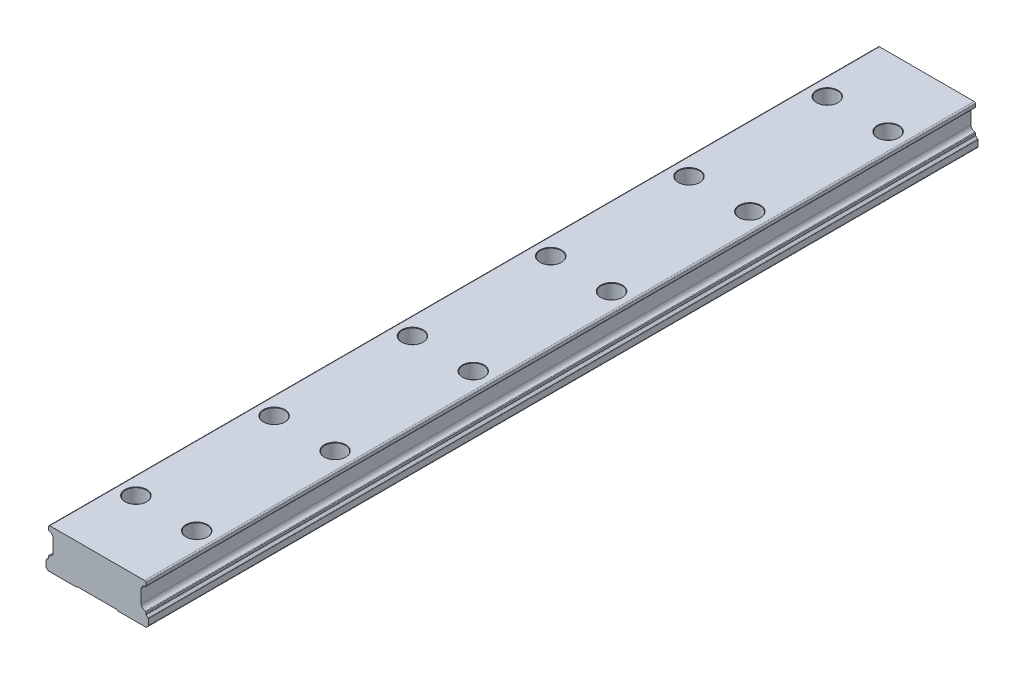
SolidWorks part; units mm, degrees
ref_plane "基準面1" through (0, 0, 0) normal (0, 0, 1) x (1, 0, 0)
ref_plane "基準面2" through (0, 0, 0) normal (0, 1, 0) x (1, 0, 0)
ref_plane "基準面3" through (0, 0, 0) normal (1, 0, 0) x (0, 0, -1)
sketch "草圖11" plane through (0, 0, 0) normal (0, 0, 1) x (1, 0, 0)
  line L0 (0, 0) -> (0, 16.4047) construction
  line L1 (-17.5, 11.05) -> (-17.5, 6.55) construction
  circle A0 centre (-17.5, 11.05) radius 1.5875
  circle A1 centre (-17.5, 6.55) radius 1.5875
  circle A2 centre (17.5, 6.55) radius 1.5875
  circle A3 centre (17.5, 11.05) radius 1.5875
  dimension "D1" = 6.55
  dimension "D2" = 4.5
  dimension "D3" = 3.175
  dimension "D4" = 35
sketch "草圖1" plane through (0, 0, 0) normal (0, 0, 1) x (1, 0, 0)
  line L0 (-9.0449, 8.8) -> (10.9551, 8.8) construction
  line L1 (-17.75, 0) -> (-7.5, 0)
  line L2 (-18.5, 0.9571) -> (-18.5, 3.0782)
  line L3 (-17.1, 14.4) -> (17.1, 14.4)
  line L4 (18.5, 0.9571) -> (18.5, 3.0782)
  line L5 (0, 0) -> (0, 20) construction
  line L6 (-15.9109, 11.2398) -> (-15.9109, 6.3602)
  line L7 (15.9109, 6.3602) -> (15.9109, 11.2398)
  line L9 (17.6, 4.7041) -> (17.6, 4.0666)
  line L10 (-17.6893, 3.8751) -> (-18.4107, 3.2697)
  line L11 (-17.6, 12.8959) -> (-17.6, 13.9)
  line L12 (17.6, 12.8959) -> (17.6, 13.9)
  line L13 (17.6893, 3.8751) -> (18.4107, 3.2697)
  line L14 (-17.6, 4.7041) -> (-17.6, 4.0666)
  line L18 (-18.3536, 0.6036) -> (-17.75, 0)
  line L19 (18.3536, 0.6036) -> (17.75, 0)
  line L23 (17.5442, 11.0058) -> (17.5, 11.05) construction
  line L24 (-7.5, 0) -> (-7.2, 0.3)
  line L25 (-7.2, 0.3) -> (7.2, 0.3)
  line L28 (7.5, 0) -> (7.2, 0.3)
  line L30 (7.5, 0) -> (17.75, 0)
  arc A0 (-15.9109, 11.2398) -> (-17.3756, 12.6472) centre (-17.5442, 11.0058) ccw
  arc A1 (-17.3756, 4.9528) -> (-15.9109, 6.3602) centre (-17.5442, 6.5942) ccw
  arc A2 (17.3756, 4.9528) -> (15.9109, 6.3602) centre (17.5442, 6.5942) cw
  arc A3 (15.9109, 11.2398) -> (17.3756, 12.6472) centre (17.5442, 11.0058) cw
  arc A4 (-17.3756, 4.9528) -> (-17.6, 4.7041) centre (-17.35, 4.7041) ccw
  arc A5 (-17.3756, 12.6472) -> (-17.6, 12.8959) centre (-17.35, 12.8959) cw
  arc A9 (17.6, 4.7041) -> (17.3756, 4.9528) centre (17.35, 4.7041) ccw
  arc A11 (17.6, 12.8959) -> (17.3756, 12.6472) centre (17.35, 12.8959) cw
  arc A16 (-17.6893, 3.8751) -> (-17.6, 4.0666) centre (-17.85, 4.0666) ccw
  arc A17 (-18.5, 3.0782) -> (-18.4107, 3.2697) centre (-18.25, 3.0782) cw
  arc A18 (17.6893, 3.8751) -> (17.6, 4.0666) centre (17.85, 4.0666) cw
  arc A19 (18.5, 3.0782) -> (18.4107, 3.2697) centre (18.25, 3.0782) ccw
  arc A20 (-17.6, 13.9) -> (-17.1, 14.4) centre (-17.1, 13.9) cw
  arc A21 (17.6, 13.9) -> (17.1, 14.4) centre (17.1, 13.9) ccw
  circle A22 centre (17.5, 11.05) radius 1.5875 construction
  arc A23 (-18.3536, 0.6036) -> (-18.5, 0.9571) centre (-18, 0.9571) cw
  arc A24 (18.3536, 0.6036) -> (18.5, 0.9571) centre (18, 0.9571) ccw
  point P31 (-17.6, 4.9451)
  point P34 (-17.6, 12.6549)
  point P46 (17.6, 4.9451)
  point P52 (17.6, 12.6549)
  point P67 (-17.6, 3.95)
  point P70 (-18.5, 3.1948)
  point P73 (17.6, 3.95)
  point P76 (18.5, 3.1948)
  point P89 (-17.6, 3.95)
  point P90 (-17.6, 3.95)
  point P96 (-18.5, 0.75)
  point P99 (18.5, 0.75)
  dimension "D4" = 1.65
  dimension "D6" = 35.2
  dimension "D9" = 5.6
  dimension "D11" = 35.0884
  dimension "D13" = 0.25
  dimension "D14" = 0.5
  dimension "D20" = 0.5
  dimension "D26" = 4.4116
  dimension "D28" = 0.5
  dimension "D3" = 8.8
  dimension "D10" = 130
  dimension "D12" = 4.85
  dimension "D15" = 35.2
  dimension "D16" = 45
  dimension "D17" = 0.75
  dimension "D18" = 37
  dimension "D21" = 1.0041
  dimension "D22" = 45
  dimension "D23" = 0.3
  dimension "D24" = 5.6
  dimension "D25" = 15
  dimension "D29" = 2.4448
  dimension "D30" = 0.7552
extrude "Extrude" add sketch "草圖1" along normal blind 300
sketch "草圖2" plane through (0, 0, 300) normal (0, 0, 1) x (1, 0, 0)
  line L0 (0, 0) -> (0, 15.6466) construction
  line L1 (-9.1116, 8.8) -> (10.0748, 8.8) construction
  line L2 (-17.75, 0) -> (-7.5, 0) construction
  line L3 (17.5, 6.55) -> (17.3756, 4.9528) construction
  line L4 (17.5, 6.55) -> (15.9109, 6.3602) construction
  line L5 (17.5, 6.55) -> (10.0696, -0.8804) construction
  line L6 (18.5, 0.9571) -> (18.5, 3.0782) construction
  line L7 (-17.3756, 12.6472) -> (-7.3819, 11.6204) construction
  line L8 (-17.5, 11.05) -> (-8.4279, 20.1221) construction
  line L9 (-17.5, 11.05) -> (-17.3756, 12.6472) construction
  line L10 (-17.5, 11.05) -> (-15.9109, 11.2398) construction
  line L11 (-17.5, 11.05) -> (-13.5587, 10.4961) construction
  line L12 (17.1, 14.4) -> (-17.1, 14.4) construction
  line L13 (-17.75, 0) -> (-7.5, 0) construction
  circle A0 centre (-17.5, 11.05) radius 1.5875
  circle A1 centre (-17.5, 6.55) radius 1.5875
  circle A2 centre (17.5, 6.55) radius 1.5875
  circle A3 centre (17.5, 11.05) radius 1.5875
  arc A4 (-15.9109, 11.2398) -> (-17.3756, 12.6472) centre (-17.5442, 11.0058) ccw construction
  arc A5 (-15.9109, 11.2398) -> (-17.3756, 12.6472) centre (-17.5442, 11.0058) ccw construction
  dimension "D2" = 35
  dimension "D3" = 4.5
  dimension "D4" = 3.175
  dimension "D14" = 3.35
  dimension "D15" = 6.55
  dimension "D1" = 8.8
  dimension "D5" = 45
  dimension "D6" = 38.188
  dimension "D7" = 40.545
  dimension "D8" = 185.866
  dimension "D9" = 45
  dimension "D10" = 230.866
  dimension "D11" = 40.545
  dimension "D12" = 38.188
  dimension "D13" = 8
sketch "草圖3" plane through (0, 0, 300) normal (0, 0, 1) x (1, 0, 0)
  line L1 (0, 14.55) -> (0, 5.1376) construction
  line L3 (7.7, -0.2) -> (17.9743, -0.2)
  line L6 (0, 0) -> (0, 20) construction
  line L7 (-15.9, 8.8) -> (-2.3425, 8.8) construction
  line L8 (-9.0449, 8.8) -> (10.9551, 8.8) construction
  line L11 (-18.3536, 0.6036) -> (-17.75, 0) construction
  line L15 (-7.2, 0.3) -> (-7.5, 0)
  line L16 (7.5, 0) -> (7.2, 0.3)
  line L18 (-18.5657, 0.3914) -> (-17.8743, -0.3)
  line L19 (-19.0004, 0.8261) -> (-17.9743, -0.2)
  line L20 (-17.9743, -0.2) -> (-7.7, -0.2)
  line L21 (-17.75, 0) -> (-7.5, 0) construction
  line L22 (-17.4, 14.55) -> (17.4, 14.55)
  line L23 (17.1, 14.4) -> (-17.1, 14.4) construction
  line L24 (17.8743, -0.3) -> (18.5657, 0.3914)
  line L25 (17.9743, -0.2) -> (18.5657, 0.3914)
  line L29 (7.2, 0.3) -> (-7.2, 0.3)
  line L31 (-7.2, 0.3) -> (-7.7, -0.2)
  line L33 (7.7, -0.2) -> (7.2, 0.3)
  line L36 (-18.8, 3.0782) -> (-18.8, 0.9571)
  line L38 (-17.8743, -0.3) -> (-7.3757, -0.3)
  line L39 (-16.2109, 11.2174) -> (-16.2109, 6.3826)
  line L40 (18.8, 0.9571) -> (18.8, 3.0782)
  line L41 (18.6035, 3.4996) -> (17.9, 4.0899)
  line L42 (17.9, 4.0899) -> (17.9, 4.7041)
  line L43 (-16.2109, 11.2174) -> (-16.2109, 6.3826)
  line L44 (16.2109, 6.3826) -> (16.2109, 11.2174)
  line L45 (16.2109, 6.3826) -> (16.2109, 11.2174)
  line L46 (17.9, 12.8959) -> (17.9, 13.9)
  line L47 (17.1, 14.7) -> (-17.1, 14.7)
  line L48 (-17.9, 13.9) -> (-17.9, 12.8959)
  line L52 (-17.9, 4.7041) -> (-17.9, 4.0899)
  line L53 (-17.9, 4.0899) -> (-18.6035, 3.4996)
  line L54 (-18.8, 3.0782) -> (-18.8, 0.9571)
  line L55 (7.2, 0.3) -> (-7.2, 0.3)
  line L56 (-7.3757, -0.3) -> (-7.0757, 0)
  line L58 (18.8, 0.9571) -> (18.8, 3.0782)
  line L59 (18.6035, 3.4996) -> (18.0786, 3.94)
  line L60 (17.9, 4.8501) -> (17.9, 4.323)
  line L61 (-7.0757, 0) -> (7.0757, 0)
  line L64 (17.9, 12.7499) -> (17.9, 14.05)
  line L66 (-17.9, 14.05) -> (-17.9, 12.7499)
  line L70 (-17.9, 4.8501) -> (-17.9, 4.323)
  line L71 (-18.0786, 3.94) -> (-18.6035, 3.4996)
  line L77 (7.0757, 0) -> (7.3757, -0.3)
  line L79 (7.3757, -0.3) -> (17.8743, -0.3)
  arc A0 (-18.0786, 3.94) -> (-17.9, 4.323) centre (-18.4, 4.323) ccw
  arc A1 (18.0786, 3.94) -> (17.9, 4.323) centre (18.4, 4.323) cw
  arc A2 (-17.9, 14.05) -> (-17.4, 14.55) centre (-17.4, 14.05) cw
  arc A3 (17.4, 14.55) -> (17.9, 14.05) centre (17.4, 14.05) cw
  arc A4 (-16.3296, 11.3012) -> (-17.4412, 12.2516) centre (-17.5442, 11.0058) ccw
  arc A5 (-15.9109, 11.2398) -> (-17.3756, 12.6472) centre (-17.5442, 11.0058) ccw construction
  arc A6 (-17.9, 12.7499) -> (-17.4412, 12.2516) centre (-17.4, 12.7499) ccw
  arc A7 (-16.1219, 11.0038) -> (-16.3296, 11.3012) centre (-15.8437, 11.4193) cw
  arc A8 (15.9, 10.5883) -> (16.1219, 11.0038) centre (16.4, 10.5883) cw
  arc A9 (16.1219, 11.0038) -> (16.3296, 11.3012) centre (15.8437, 11.4193) ccw
  arc A10 (17.9, 12.7499) -> (17.4412, 12.2516) centre (17.4, 12.7499) cw
  arc A11 (16.3296, 11.3012) -> (17.4412, 12.2516) centre (17.5442, 11.0058) cw
  arc A12 (-16.3296, 6.2988) -> (-17.4412, 5.3484) centre (-17.5442, 6.5942) cw
  arc A13 (-17.9, 4.8501) -> (-17.4412, 5.3484) centre (-17.4, 4.8501) cw
  arc A14 (-16.3296, 6.2988) -> (-16.1219, 6.5962) centre (-15.8437, 6.1807) cw
  arc A15 (16.3296, 6.2988) -> (16.1219, 6.5962) centre (15.8437, 6.1807) ccw
  arc A16 (17.9, 4.8501) -> (17.4412, 5.3484) centre (17.4, 4.8501) ccw
  arc A17 (16.3296, 6.2988) -> (17.4412, 5.3484) centre (17.5442, 6.5942) ccw
  arc A25 (-15.9, 10.5883) -> (-16.1219, 11.0038) centre (-16.4, 10.5883) ccw
  arc A26 (-15.9, 7.0117) -> (-16.1219, 6.5962) centre (-16.4, 7.0117) cw
  arc A28 (15.9, 7.0117) -> (16.1219, 6.5962) centre (16.4, 7.0117) ccw
  arc A30 (-17.1, 14.7) -> (-17.9, 13.9) centre (-17.1, 13.9) ccw
  arc A32 (17.9, 13.9) -> (17.1, 14.7) centre (17.1, 13.9) ccw
  arc A44 (18.8, 3.0782) -> (18.6035, 3.4996) centre (18.25, 3.0782) ccw
  arc A46 (17.9, 4.7041) -> (17.4062, 5.2513) centre (17.35, 4.7041) ccw
  arc A47 (16.2109, 6.3826) -> (17.4062, 5.2513) centre (17.5442, 6.5942) ccw
  arc A52 (17.4062, 12.3487) -> (16.2109, 11.2174) centre (17.5442, 11.0058) ccw
  arc A53 (17.4062, 12.3487) -> (17.9, 12.8959) centre (17.35, 12.8959) ccw
  arc A54 (-18.8, 0.9571) -> (-18.5657, 0.3914) centre (-18, 0.9571) ccw
  arc A55 (-18.8, 0.9571) -> (-18.5657, 0.3914) centre (-18, 0.9571) ccw
  arc A56 (-17.9, 12.8959) -> (-17.4062, 12.3487) centre (-17.35, 12.8959) ccw
  arc A57 (-16.2109, 11.2174) -> (-17.4062, 12.3487) centre (-17.5442, 11.0058) ccw
  arc A59 (18.5657, 0.3914) -> (18.8, 0.9571) centre (18, 0.9571) ccw
  arc A60 (18.5657, 0.3914) -> (18.8, 0.9571) centre (18, 0.9571) ccw
  arc A62 (-17.4062, 5.2513) -> (-16.2109, 6.3826) centre (-17.5442, 6.5942) ccw
  arc A63 (-17.4062, 5.2513) -> (-17.9, 4.7041) centre (-17.35, 4.7041) ccw
  arc A65 (-18.6035, 3.4996) -> (-18.8, 3.0782) centre (-18.25, 3.0782) ccw
  arc A66 (18.8, 3.0782) -> (18.6035, 3.4996) centre (18.25, 3.0782) ccw
  arc A87 (-18.6035, 3.4996) -> (-18.8, 3.0782) centre (-18.25, 3.0782) ccw
  dimension "D4" = 0.5
  dimension "D5" = 0.5
  dimension "D6" = 2.5
  dimension "D7" = 0.5
  dimension "D8" = 0.5
  dimension "D9" = 0.5
  dimension "D11" = 0.5
  dimension "D12" = 0.5
  dimension "D13" = 1.7883
  dimension "D2" = 0.2
  dimension "D3" = 0.15
  dimension "D10" = 0
  dimension "D1" = 0.3
sketch "草圖6" [suppressed] plane through (0, 0, 100) normal (0, 0, 1) x (1, 0, 0)
  arc A45 (-3.8216, 12.4118) -> (-5.9206, 14.342) centre (-6.567, 11.5326) ccw
  arc A48 (-5.9206, 4.358) -> (-3.8216, 6.2882) centre (-6.567, 7.1674) ccw
  arc A51 (3.8216, 6.2882) -> (5.9206, 4.358) centre (6.567, 7.1674) ccw
  arc A54 (5.9206, 14.342) -> (3.8216, 12.4118) centre (6.567, 11.5326) ccw
hole_wizard "Hole1" positions "草圖8" profile "草圖7" counterbore size "M4" standard "ISO"
sketch "草圖8" plane through (0, 14.4, 0) normal (0, 1, 0) x (-1, 0, 0)
  line L0 (0, 0) -> (0, 27.4785) construction
  line L3 (-17.1, 0) -> (17.1, 0) construction
  point P0 (-11, 25)
  point P47 (11, 25)
  dimension "D1" = 22
  dimension "D2" = 25
sketch "草圖7" plane through (11, 14.4, 25) normal (1, 0, 0) x (0, 0, 1)
  line L0 (0, 0) -> (0, 14.4)
  line L1 (2.25, 14.15) -> (2.5, 14.4)
  line L2 (3.75, 5.3) -> (2.25, 5.3)
  line L3 (2.25, 5.3) -> (2.25, 14.15)
  line L5 (3.75, 5.3) -> (3.75, 0.15)
  line L6 (3.75, 0.15) -> (3.9, 0)
  line L7 (3.9, 0) -> (0, 0)
  line L8 (-3.75, 0.15) -> (-3.9, 0) construction
  line L11 (0, -6.35) -> (0, 107.95) construction
  line L12 (2.5, 14.4) -> (0, 14.4)
  line L13 (-2.25, 14.15) -> (-2.5, 14.4) construction
  dimension "貫穿孔直徑" = 4.5
  dimension "貫穿孔深度" = 14.4
  dimension "柱孔直徑" = 7.5
  dimension "柱孔深度" = 5.3
  dimension "近端錐孔直徑" = 7.8
  dimension "近端錐孔角度" = 90
  dimension "遠端錐孔直徑" = 5
  dimension "遠端錐孔角度" = 90
fillet "Fillet1" [suppressed] radius 0.5
sketch "草圖9" plane through (0, 0, 300) normal (0, 0, 1) x (1, 0, 0)
  line L18 (-15.9109, 11.2398) -> (-15.9109, 6.3602)
  line L19 (-15.9109, 11.2398) -> (-15.9109, 6.3602)
  line L20 (15.9109, 6.3602) -> (15.9109, 11.2398)
  line L21 (15.9109, 6.3602) -> (15.9109, 11.2398)
  line L25 (-17.6, 13.9) -> (-17.6, 12.8959)
  line L29 (-17.6, 4.7041) -> (-17.6, 4.0666)
  line L30 (-17.6893, 3.8751) -> (-18.4107, 3.2697)
  line L31 (-18.5, 3.0782) -> (-18.5, 0.9571)
  line L32 (-18.3536, 0.6036) -> (-17.75, 0)
  line L33 (-17.75, 0) -> (-7.5, 0)
  line L34 (-7.5, 0) -> (-7.2, 0.3)
  line L35 (-7.2, 0.3) -> (7.2, 0.3)
  line L36 (7.2, 0.3) -> (7.5, 0)
  line L37 (7.5, 0) -> (17.75, 0)
  line L38 (17.75, 0) -> (18.3536, 0.6036)
  line L39 (18.5, 0.9571) -> (18.5, 3.0782)
  line L40 (18.4107, 3.2697) -> (17.6893, 3.8751)
  line L41 (17.6, 4.0666) -> (17.6, 4.7041)
  line L45 (17.6, 12.8959) -> (17.6, 13.9)
  line L47 (17.1, 14.4) -> (-17.1, 14.4)
  line L49 (-17.6, 13.9) -> (-17.6, 12.8959)
  line L53 (-17.6, 4.7041) -> (-17.6, 4.0666)
  line L54 (-17.6893, 3.8751) -> (-18.4107, 3.2697)
  line L55 (-18.5, 3.0782) -> (-18.5, 0.9571)
  line L56 (-18.3536, 0.6036) -> (-17.75, 0)
  line L57 (-17.75, 0) -> (-7.5, 0)
  line L58 (-7.5, 0) -> (-7.2, 0.3)
  line L59 (-7.2, 0.3) -> (7.2, 0.3)
  line L60 (7.2, 0.3) -> (7.5, 0)
  line L61 (7.5, 0) -> (17.75, 0)
  line L62 (17.75, 0) -> (18.3536, 0.6036)
  line L63 (18.5, 0.9571) -> (18.5, 3.0782)
  line L64 (18.4107, 3.2697) -> (17.6893, 3.8751)
  line L65 (17.6, 4.0666) -> (17.6, 4.7041)
  line L69 (17.6, 12.8959) -> (17.6, 13.9)
  line L71 (17.1, 14.4) -> (-17.1, 14.4)
  arc A22 (-17.1, 14.4) -> (-17.6, 13.9) centre (-17.1, 13.9) ccw
  arc A23 (-17.6, 12.8959) -> (-17.3756, 12.6472) centre (-17.35, 12.8959) ccw
  arc A24 (-15.9109, 11.2398) -> (-17.3756, 12.6472) centre (-17.5442, 11.0058) ccw
  arc A29 (-17.3756, 4.9528) -> (-15.9109, 6.3602) centre (-17.5442, 6.5942) ccw
  arc A30 (-17.3756, 4.9528) -> (-17.6, 4.7041) centre (-17.35, 4.7041) ccw
  arc A31 (-17.6893, 3.8751) -> (-17.6, 4.0666) centre (-17.85, 4.0666) ccw
  arc A32 (-18.4107, 3.2697) -> (-18.5, 3.0782) centre (-18.25, 3.0782) ccw
  arc A33 (18.5, 3.0782) -> (18.4107, 3.2697) centre (18.25, 3.0782) ccw
  arc A34 (17.6, 4.0666) -> (17.6893, 3.8751) centre (17.85, 4.0666) ccw
  arc A35 (17.6, 4.7041) -> (17.3756, 4.9528) centre (17.35, 4.7041) ccw
  arc A36 (15.9109, 6.3602) -> (17.3756, 4.9528) centre (17.5442, 6.5942) ccw
  arc A41 (17.3756, 12.6472) -> (15.9109, 11.2398) centre (17.5442, 11.0058) ccw
  arc A42 (17.3756, 12.6472) -> (17.6, 12.8959) centre (17.35, 12.8959) ccw
  arc A43 (17.6, 13.9) -> (17.1, 14.4) centre (17.1, 13.9) ccw
  arc A44 (-17.1, 14.4) -> (-17.6, 13.9) centre (-17.1, 13.9) ccw
  arc A45 (-17.6, 12.8959) -> (-17.3756, 12.6472) centre (-17.35, 12.8959) ccw
  arc A46 (-15.9109, 11.2398) -> (-17.3756, 12.6472) centre (-17.5442, 11.0058) ccw
  arc A51 (-17.3756, 4.9528) -> (-15.9109, 6.3602) centre (-17.5442, 6.5942) ccw
  arc A52 (-17.3756, 4.9528) -> (-17.6, 4.7041) centre (-17.35, 4.7041) ccw
  arc A53 (-17.6893, 3.8751) -> (-17.6, 4.0666) centre (-17.85, 4.0666) ccw
  arc A54 (-18.4107, 3.2697) -> (-18.5, 3.0782) centre (-18.25, 3.0782) ccw
  arc A55 (18.5, 3.0782) -> (18.4107, 3.2697) centre (18.25, 3.0782) ccw
  arc A56 (17.6, 4.0666) -> (17.6893, 3.8751) centre (17.85, 4.0666) ccw
  arc A57 (17.6, 4.7041) -> (17.3756, 4.9528) centre (17.35, 4.7041) ccw
  arc A58 (15.9109, 6.3602) -> (17.3756, 4.9528) centre (17.5442, 6.5942) ccw
  arc A63 (17.3756, 12.6472) -> (15.9109, 11.2398) centre (17.5442, 11.0058) ccw
  arc A64 (17.3756, 12.6472) -> (17.6, 12.8959) centre (17.35, 12.8959) ccw
  arc A65 (17.6, 13.9) -> (17.1, 14.4) centre (17.1, 13.9) ccw
  arc A68 (-18.5, 0.9571) -> (-18.3536, 0.6036) centre (-18, 0.9571) ccw
  arc A69 (-18.5, 0.9571) -> (-18.3536, 0.6036) centre (-18, 0.9571) ccw
  arc A70 (18.3536, 0.6036) -> (18.5, 0.9571) centre (18, 0.9571) ccw
  arc A71 (18.3536, 0.6036) -> (18.5, 0.9571) centre (18, 0.9571) ccw
  dimension "D1" = 0
sketch "草圖10" plane through (0, 0, 0) normal (0, 0, 1) x (1, 0, 0)
  line L18 (-15.9109, 11.2398) -> (-15.9109, 6.3602)
  line L19 (-15.9109, 11.2398) -> (-15.9109, 6.3602)
  line L20 (15.9109, 6.3602) -> (15.9109, 11.2398)
  line L21 (15.9109, 6.3602) -> (15.9109, 11.2398)
  line L24 (17.6, 12.8959) -> (17.6, 13.9)
  line L26 (17.1, 14.4) -> (-17.1, 14.4)
  line L28 (-17.6, 13.9) -> (-17.6, 12.8959)
  line L32 (-17.6, 4.7041) -> (-17.6, 4.0666)
  line L33 (-17.6893, 3.8751) -> (-18.4107, 3.2697)
  line L34 (-18.5, 3.0782) -> (-18.5, 0.9571)
  line L35 (-18.3536, 0.6036) -> (-17.75, 0)
  line L36 (-17.75, 0) -> (-7.5, 0)
  line L37 (-7.5, 0) -> (-7.2, 0.3)
  line L38 (-7.2, 0.3) -> (7.2, 0.3)
  line L39 (7.2, 0.3) -> (7.5, 0)
  line L40 (7.5, 0) -> (17.75, 0)
  line L41 (17.75, 0) -> (18.3536, 0.6036)
  line L42 (18.5, 0.9571) -> (18.5, 3.0782)
  line L43 (18.4107, 3.2697) -> (17.6893, 3.8751)
  line L44 (17.6, 4.0666) -> (17.6, 4.7041)
  line L48 (17.6, 12.8959) -> (17.6, 13.9)
  line L50 (17.1, 14.4) -> (-17.1, 14.4)
  line L52 (-17.6, 13.9) -> (-17.6, 12.8959)
  line L56 (-17.6, 4.7041) -> (-17.6, 4.0666)
  line L57 (-17.6893, 3.8751) -> (-18.4107, 3.2697)
  line L58 (-18.5, 3.0782) -> (-18.5, 0.9571)
  line L59 (-18.3536, 0.6036) -> (-17.75, 0)
  line L60 (-17.75, 0) -> (-7.5, 0)
  line L61 (-7.5, 0) -> (-7.2, 0.3)
  line L62 (-7.2, 0.3) -> (7.2, 0.3)
  line L63 (7.2, 0.3) -> (7.5, 0)
  line L64 (7.5, 0) -> (17.75, 0)
  line L65 (17.75, 0) -> (18.3536, 0.6036)
  line L66 (18.5, 0.9571) -> (18.5, 3.0782)
  line L67 (18.4107, 3.2697) -> (17.6893, 3.8751)
  line L68 (17.6, 4.0666) -> (17.6, 4.7041)
  circle A1 centre (17.5, 11.05) radius 1.5875
  circle A2 centre (17.5, 11.05) radius 1.5875
  circle A3 centre (17.5, 6.55) radius 1.5875
  circle A4 centre (17.5, 6.55) radius 1.5875
  circle A5 centre (-17.5, 6.55) radius 1.5875
  circle A6 centre (-17.5, 6.55) radius 1.5875
  circle A7 centre (-17.5, 11.05) radius 1.5875
  circle A8 centre (-17.5, 11.05) radius 1.5875
  arc A30 (17.6, 13.9) -> (17.1, 14.4) centre (17.1, 13.9) ccw
  arc A31 (-17.1, 14.4) -> (-17.6, 13.9) centre (-17.1, 13.9) ccw
  arc A32 (-17.6, 12.8959) -> (-17.3756, 12.6472) centre (-17.35, 12.8959) ccw
  arc A33 (-15.9109, 11.2398) -> (-17.3756, 12.6472) centre (-17.5442, 11.0058) ccw
  arc A38 (-17.3756, 4.9528) -> (-15.9109, 6.3602) centre (-17.5442, 6.5942) ccw
  arc A39 (-17.3756, 4.9528) -> (-17.6, 4.7041) centre (-17.35, 4.7041) ccw
  arc A40 (-17.6893, 3.8751) -> (-17.6, 4.0666) centre (-17.85, 4.0666) ccw
  arc A41 (-18.4107, 3.2697) -> (-18.5, 3.0782) centre (-18.25, 3.0782) ccw
  arc A42 (18.5, 3.0782) -> (18.4107, 3.2697) centre (18.25, 3.0782) ccw
  arc A43 (17.6, 4.0666) -> (17.6893, 3.8751) centre (17.85, 4.0666) ccw
  arc A44 (17.6, 4.7041) -> (17.3756, 4.9528) centre (17.35, 4.7041) ccw
  arc A45 (15.9109, 6.3602) -> (17.3756, 4.9528) centre (17.5442, 6.5942) ccw
  arc A50 (17.3756, 12.6472) -> (15.9109, 11.2398) centre (17.5442, 11.0058) ccw
  arc A51 (17.3756, 12.6472) -> (17.6, 12.8959) centre (17.35, 12.8959) ccw
  arc A52 (17.6, 13.9) -> (17.1, 14.4) centre (17.1, 13.9) ccw
  arc A53 (-17.1, 14.4) -> (-17.6, 13.9) centre (-17.1, 13.9) ccw
  arc A54 (-17.6, 12.8959) -> (-17.3756, 12.6472) centre (-17.35, 12.8959) ccw
  arc A55 (-15.9109, 11.2398) -> (-17.3756, 12.6472) centre (-17.5442, 11.0058) ccw
  arc A60 (-17.3756, 4.9528) -> (-15.9109, 6.3602) centre (-17.5442, 6.5942) ccw
  arc A61 (-17.3756, 4.9528) -> (-17.6, 4.7041) centre (-17.35, 4.7041) ccw
  arc A62 (-17.6893, 3.8751) -> (-17.6, 4.0666) centre (-17.85, 4.0666) ccw
  arc A63 (-18.4107, 3.2697) -> (-18.5, 3.0782) centre (-18.25, 3.0782) ccw
  arc A64 (18.5, 3.0782) -> (18.4107, 3.2697) centre (18.25, 3.0782) ccw
  arc A65 (17.6, 4.0666) -> (17.6893, 3.8751) centre (17.85, 4.0666) ccw
  arc A66 (17.6, 4.7041) -> (17.3756, 4.9528) centre (17.35, 4.7041) ccw
  arc A67 (15.9109, 6.3602) -> (17.3756, 4.9528) centre (17.5442, 6.5942) ccw
  arc A72 (17.3756, 12.6472) -> (15.9109, 11.2398) centre (17.5442, 11.0058) ccw
  arc A73 (17.3756, 12.6472) -> (17.6, 12.8959) centre (17.35, 12.8959) ccw
  arc A76 (-18.5, 0.9571) -> (-18.3536, 0.6036) centre (-18, 0.9571) ccw
  arc A77 (-18.5, 0.9571) -> (-18.3536, 0.6036) centre (-18, 0.9571) ccw
  arc A78 (18.3536, 0.6036) -> (18.5, 0.9571) centre (18, 0.9571) ccw
  arc A79 (18.3536, 0.6036) -> (18.5, 0.9571) centre (18, 0.9571) ccw
  dimension "D6" = 35
  dimension "D7" = 4.5
  dimension "D1" = 0
  dimension "D2" = 0
  dimension "D3" = 0
  dimension "D4" = 0
  dimension "D5" = 0
pattern_linear "Copy1" count 6 spacing 50 along (0, 0, 1) of "Hole1"
sketch "草圖12" plane through (0, 0, 300) normal (0, 0, 1) x (1, 0, 0)
  line L0 (-17.5, 11.05) -> (-15.9109, 11.2398) construction
  line L1 (-17.5, 11.05) -> (-14.1149, 11.05) construction
  line L2 (-17.5, 11.05) -> (-17.3756, 12.6472) construction
  line L3 (-17.5, 11.05) -> (-17.5, 6.55) construction
  line L4 (-15.9109, 11.2398) -> (-15.9109, 6.3602) construction
  line L6 (-15.9109, 10.8057) -> (-15.9109, 6.7943)
  line L7 (-14.75, 14.25) -> (-14.75, 9.1) construction
  arc A0 (-15.9109, 11.2398) -> (-17.3756, 12.6472) centre (-17.5442, 11.0058) ccw construction
  dimension "D1" = 6.812
  dimension "D2" = 4.455
  dimension "D3" = 1.1609
fillet "Fillet2" radius 0.25 4 edges at (17.75, 0, 150) (7.5, 0, 150) (-7.5, 0, 150) (-17.75, 0, 150)
fillet "Fillet3" radius 0.5 2 edges at (7.2, 0.3, 150) (-7.2, 0.3, 150)
sketch "草圖13" plane through (0, 0, 300) normal (0, 0, 1) x (1, 0, 0)
  line L18 (15.9109, 6.3602) -> (15.9109, 11.2398)
  line L19 (15.9109, 6.3602) -> (15.9109, 11.2398)
  line L20 (-15.9109, 11.2398) -> (-15.9109, 6.3602)
  line L21 (-15.9109, 11.2398) -> (-15.9109, 6.3602)
  line L22 (17.8232, 0.0732) -> (18.3536, 0.6036)
  line L23 (18.5, 0.9571) -> (18.5, 3.0782)
  line L24 (18.4107, 3.2697) -> (17.6893, 3.8751)
  line L25 (17.6, 4.0666) -> (17.6, 4.7041)
  line L29 (17.6, 12.8959) -> (17.6, 13.9)
  line L30 (17.1, 14.4) -> (-17.1, 14.4)
  line L31 (-17.6, 13.9) -> (-17.6, 12.8959)
  line L35 (-17.6, 4.7041) -> (-17.6, 4.0666)
  line L36 (-17.6893, 3.8751) -> (-18.4107, 3.2697)
  line L37 (-18.5, 3.0782) -> (-18.5, 0.9571)
  line L38 (-18.3536, 0.6036) -> (-17.8232, 0.0732)
  line L39 (-17.6464, 0) -> (-7.6036, 0)
  line L40 (-7.4268, 0.0732) -> (-7.3464, 0.1536)
  line L41 (-6.9929, 0.3) -> (6.9929, 0.3)
  line L42 (7.3464, 0.1536) -> (7.4268, 0.0732)
  line L43 (7.6036, 0) -> (17.6464, 0)
  line L44 (17.8232, 0.0732) -> (18.3536, 0.6036)
  line L45 (18.5, 0.9571) -> (18.5, 3.0782)
  line L46 (18.4107, 3.2697) -> (17.6893, 3.8751)
  line L47 (17.6, 4.0666) -> (17.6, 4.7041)
  line L51 (17.6, 12.8959) -> (17.6, 13.9)
  line L52 (17.1, 14.4) -> (-17.1, 14.4)
  line L53 (-17.6, 13.9) -> (-17.6, 12.8959)
  line L57 (-17.6, 4.7041) -> (-17.6, 4.0666)
  line L58 (-17.6893, 3.8751) -> (-18.4107, 3.2697)
  line L59 (-18.5, 3.0782) -> (-18.5, 0.9571)
  line L60 (-18.3536, 0.6036) -> (-17.8232, 0.0732)
  line L61 (-17.6464, 0) -> (-7.6036, 0)
  line L62 (-7.4268, 0.0732) -> (-7.3464, 0.1536)
  line L63 (-6.9929, 0.3) -> (6.9929, 0.3)
  line L64 (7.3464, 0.1536) -> (7.4268, 0.0732)
  line L65 (7.6036, 0) -> (17.6464, 0)
  arc A30 (18.3536, 0.6036) -> (18.5, 0.9571) centre (18, 0.9571) ccw
  arc A31 (18.5, 3.0782) -> (18.4107, 3.2697) centre (18.25, 3.0782) ccw
  arc A32 (17.6, 4.0666) -> (17.6893, 3.8751) centre (17.85, 4.0666) ccw
  arc A33 (17.6, 4.7041) -> (17.3756, 4.9528) centre (17.35, 4.7041) ccw
  arc A34 (15.9109, 6.3602) -> (17.3756, 4.9528) centre (17.5442, 6.5942) ccw
  arc A39 (17.3756, 12.6472) -> (15.9109, 11.2398) centre (17.5442, 11.0058) ccw
  arc A40 (17.3756, 12.6472) -> (17.6, 12.8959) centre (17.35, 12.8959) ccw
  arc A41 (17.6, 13.9) -> (17.1, 14.4) centre (17.1, 13.9) ccw
  arc A42 (-17.1, 14.4) -> (-17.6, 13.9) centre (-17.1, 13.9) ccw
  arc A43 (-17.6, 12.8959) -> (-17.3756, 12.6472) centre (-17.35, 12.8959) ccw
  arc A44 (-15.9109, 11.2398) -> (-17.3756, 12.6472) centre (-17.5442, 11.0058) ccw
  arc A49 (-17.3756, 4.9528) -> (-15.9109, 6.3602) centre (-17.5442, 6.5942) ccw
  arc A50 (-17.3756, 4.9528) -> (-17.6, 4.7041) centre (-17.35, 4.7041) ccw
  arc A51 (-17.6893, 3.8751) -> (-17.6, 4.0666) centre (-17.85, 4.0666) ccw
  arc A52 (-18.4107, 3.2697) -> (-18.5, 3.0782) centre (-18.25, 3.0782) ccw
  arc A53 (18.3536, 0.6036) -> (18.5, 0.9571) centre (18, 0.9571) ccw
  arc A54 (-17.8232, 0.0732) -> (-17.6464, 0) centre (-17.6464, 0.25) ccw
  arc A55 (-7.6036, 0) -> (-7.4268, 0.0732) centre (-7.6036, 0.25) ccw
  arc A56 (-6.9929, 0.3) -> (-7.3464, 0.1536) centre (-6.9929, -0.2) ccw
  arc A57 (7.3464, 0.1536) -> (6.9929, 0.3) centre (6.9929, -0.2) ccw
  arc A58 (7.4268, 0.0732) -> (7.6036, 0) centre (7.6036, 0.25) ccw
  arc A59 (17.6464, 0) -> (17.8232, 0.0732) centre (17.6464, 0.25) ccw
  arc A60 (-18.5, 0.9571) -> (-18.3536, 0.6036) centre (-18, 0.9571) ccw
  arc A61 (18.5, 3.0782) -> (18.4107, 3.2697) centre (18.25, 3.0782) ccw
  arc A62 (17.6, 4.0666) -> (17.6893, 3.8751) centre (17.85, 4.0666) ccw
  arc A63 (17.6, 4.7041) -> (17.3756, 4.9528) centre (17.35, 4.7041) ccw
  arc A64 (15.9109, 6.3602) -> (17.3756, 4.9528) centre (17.5442, 6.5942) ccw
  arc A69 (17.3756, 12.6472) -> (15.9109, 11.2398) centre (17.5442, 11.0058) ccw
  arc A70 (17.3756, 12.6472) -> (17.6, 12.8959) centre (17.35, 12.8959) ccw
  arc A71 (17.6, 13.9) -> (17.1, 14.4) centre (17.1, 13.9) ccw
  arc A72 (-17.1, 14.4) -> (-17.6, 13.9) centre (-17.1, 13.9) ccw
  arc A73 (-17.6, 12.8959) -> (-17.3756, 12.6472) centre (-17.35, 12.8959) ccw
  arc A74 (-15.9109, 11.2398) -> (-17.3756, 12.6472) centre (-17.5442, 11.0058) ccw
  arc A79 (-17.3756, 4.9528) -> (-15.9109, 6.3602) centre (-17.5442, 6.5942) ccw
  arc A80 (-17.3756, 4.9528) -> (-17.6, 4.7041) centre (-17.35, 4.7041) ccw
  arc A81 (-17.6893, 3.8751) -> (-17.6, 4.0666) centre (-17.85, 4.0666) ccw
  arc A82 (-18.4107, 3.2697) -> (-18.5, 3.0782) centre (-18.25, 3.0782) ccw
  arc A83 (-18.5, 0.9571) -> (-18.3536, 0.6036) centre (-18, 0.9571) ccw
  arc A84 (-17.8232, 0.0732) -> (-17.6464, 0) centre (-17.6464, 0.25) ccw
  arc A85 (-7.6036, 0) -> (-7.4268, 0.0732) centre (-7.6036, 0.25) ccw
  arc A86 (-6.9929, 0.3) -> (-7.3464, 0.1536) centre (-6.9929, -0.2) ccw
  arc A87 (7.3464, 0.1536) -> (6.9929, 0.3) centre (6.9929, -0.2) ccw
  arc A88 (7.4268, 0.0732) -> (7.6036, 0) centre (7.6036, 0.25) ccw
  arc A89 (17.6464, 0) -> (17.8232, 0.0732) centre (17.6464, 0.25) ccw
  dimension "D1" = 0
